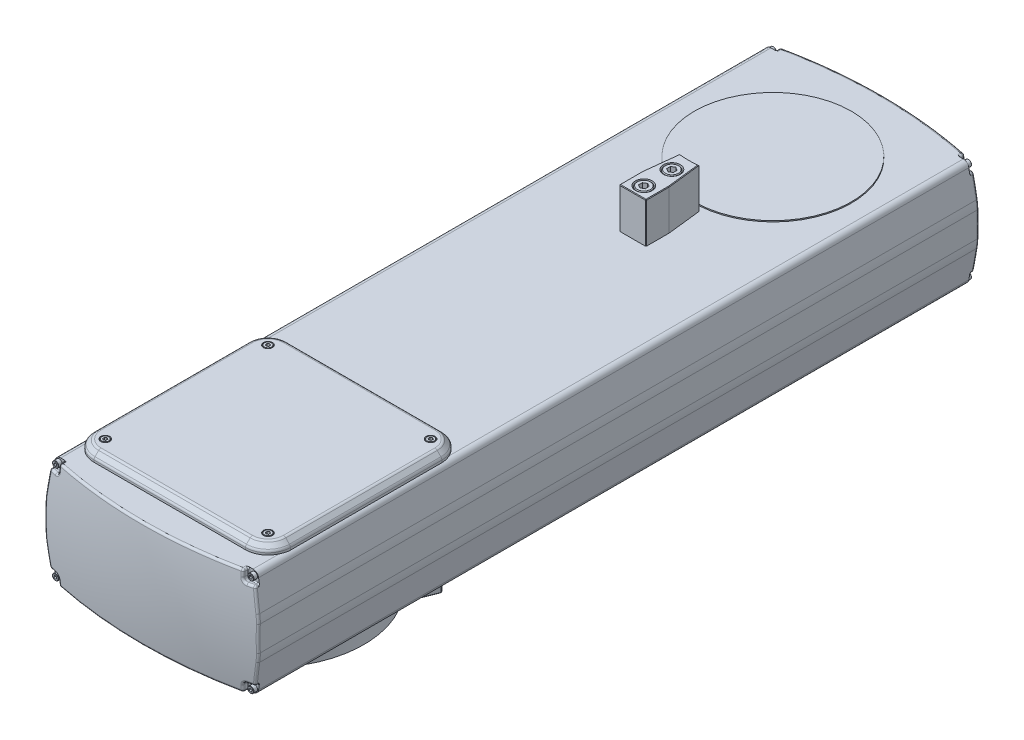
SolidWorks part; units mm, degrees
ref_plane "前视基准面" through (0, 0, 0) normal (0, 0, 1) x (1, 0, 0)
ref_plane "上视基准面" through (0, 0, 0) normal (0, 1, 0) x (1, 0, 0)
ref_plane "右视基准面" through (0, 0, 0) normal (1, 0, 0) x (0, 0, -1)
imported_body "输入1"
other "移动面1" parameters "D1"=30
other "移动面2" parameters "D1"=3
